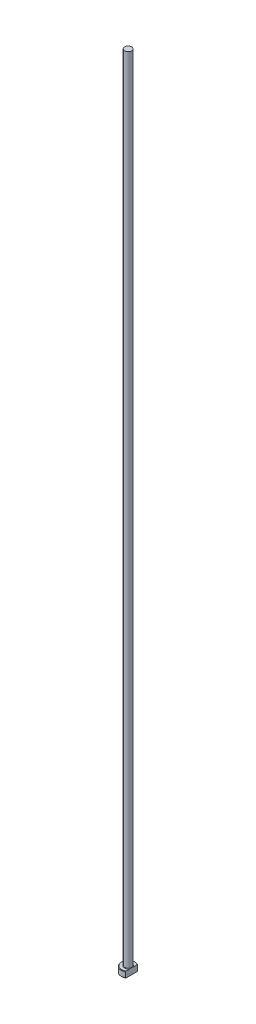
SolidWorks part; units mm, degrees
ref_plane "Front Plane" through (0, 0, 0) normal (0, 0, 1) x (1, 0, 0)
ref_plane "Top Plane" through (0, 0, 0) normal (0, 1, 0) x (1, 0, 0)
ref_plane "Right Plane" through (0, 0, 0) normal (1, 0, 0) x (0, 0, -1)
sketch "Sketch1" plane through (0, 0, 0) normal (0, 0, 1) x (1, 0, 0)
  line L0 (0, 259.9588) -> (0, -15.1925) construction
  line L1 (0, 0) -> (-3.5, 0)
  line L2 (-3.5, 0) -> (-3.5, 3)
  line L3 (-3.5, 3) -> (-1.75, 3)
  line L4 (-1.75, 3) -> (-1.75, 400)
  line L5 (-1.75, 400) -> (0, 400)
  line L6 (0, 400) -> (0, 0)
  dimension "L" = 400
  dimension "H" = 7
  dimension "T" = 3
  dimension "D" = 3.5
revolve "Revolve1" add sketch "Sketch1" angle 360 about L0
chamfer "Chamfer1" distance 0.2 angle 45 2 edges at (0, 3, 3.5) (0, 0, 3.5)
fillet "Fillet1" radius 0.2 1 edges at (0, 3, 1.75)
sketch "Sketch2" plane through (0, 0, 0) normal (0, 1, 0) x (1, 0, 0)
  line L0 (1.75, 3.0311) -> (1.75, -3.0311)
  circle A0 centre (0, 0) radius 3.5 construction
  arc A1 (1.75, -3.0311) -> (1.75, 3.0311) centre (0, 0) ccw
  circle A2 centre (0, 0) radius 1.75 construction
extrude "KEY" cut sketch "Sketch2" along normal through all
